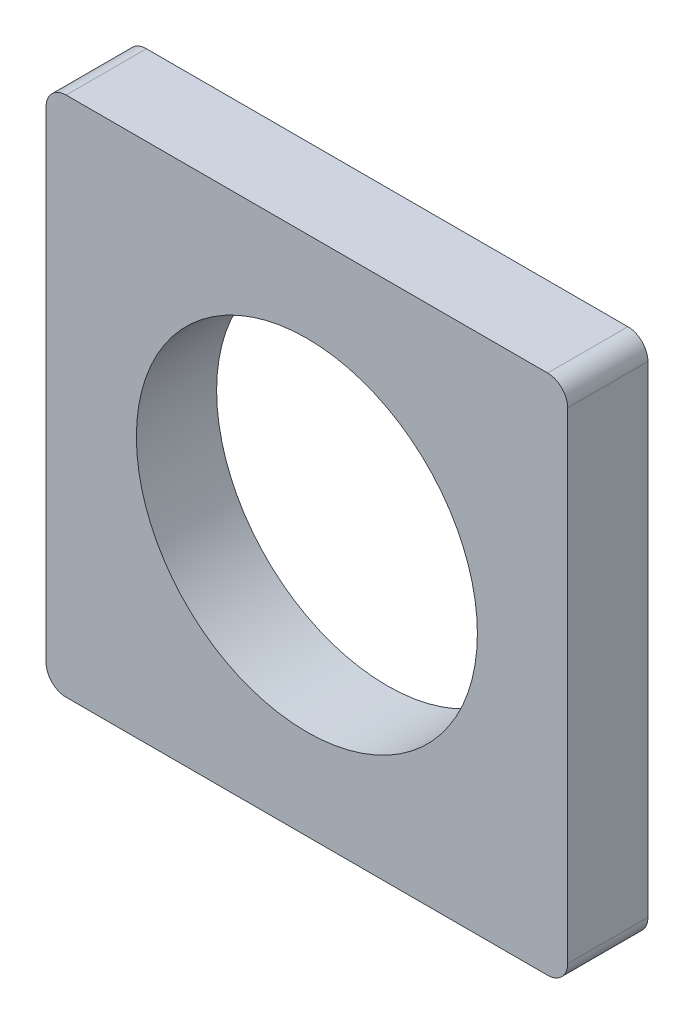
SolidWorks part; units mm, degrees
ref_plane "Front Plane" through (0, 0, 0) normal (0, 0, 1) x (1, 0, 0)
ref_plane "Top Plane" through (0, 0, 0) normal (0, 1, 0) x (1, 0, 0)
ref_plane "Right Plane" through (0, 0, 0) normal (1, 0, 0) x (0, 0, -1)
sketch "Sketch1" plane through (0, 0, 0) normal (0, 0, 1) x (1, 0, 0)
  line L1 (0.5, 0) -> (12.5, 0)
  line L2 (0, 0.5) -> (0, 12.5)
  line L3 (0.5, 13) -> (12.5, 13)
  line L4 (13, 0.5) -> (13, 12.5)
  circle A0 centre (6.5, 6.5) radius 4.25
  arc A1 (0, 0.5) -> (0.5, 0) centre (0.5, 0.5) ccw
  arc A2 (12.5, 0) -> (13, 0.5) centre (12.5, 0.5) ccw
  arc A3 (13, 12.5) -> (12.5, 13) centre (12.5, 12.5) ccw
  arc A4 (0.5, 13) -> (0, 12.5) centre (0.5, 12.5) ccw
  point P9 (0, 0)
  point P12 (13, 0)
  point P15 (13, 13)
  point P18 (0, 13)
  dimension "D3" = 0.5
  dimension "D4" = 8.5
  dimension "D1" = 13
  dimension "D2" = 13
extrude "Boss-Extrude1" add sketch "Sketch1" along normal blind 2
